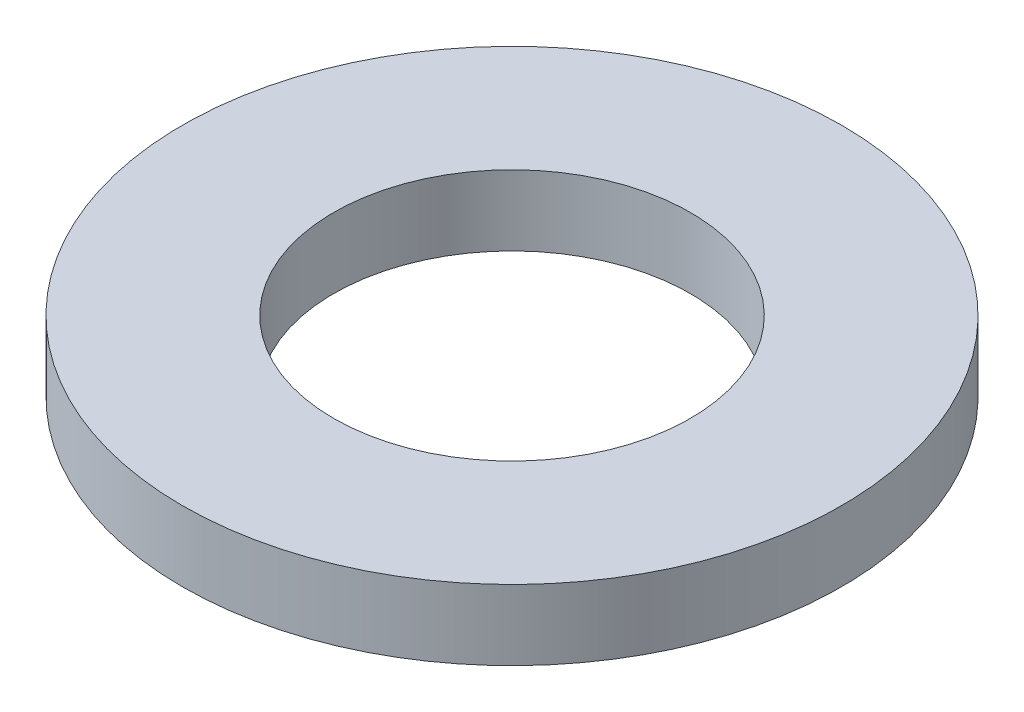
SolidWorks part; units mm, degrees
ref_plane "Front Plane" through (0, 0, 0) normal (0, 0, 1) x (1, 0, 0)
ref_plane "Top Plane" through (0, 0, 0) normal (0, 1, 0) x (1, 0, 0)
ref_plane "Right Plane" through (0, 0, 0) normal (1, 0, 0) x (0, 0, -1)
sketch "Sketch1" plane through (0, 0, 0) normal (0, 1, 0) x (1, 0, 0)
  circle A0 centre (0, 0) radius 19.05
  dimension "OD" = 38.1
extrude "Boss-Extrude1" add sketch "Sketch1" along normal blind 4.064
sketch "Sketch5" plane through (0, 4.064, 0) normal (0, 1, 0) x (-1, 0, 0)
  circle A0 centre (0, 0) radius 10.3124
  dimension "ID" = 20.6248
extrude "Cut-Extrude1" cut sketch "Sketch5" against normal through all
